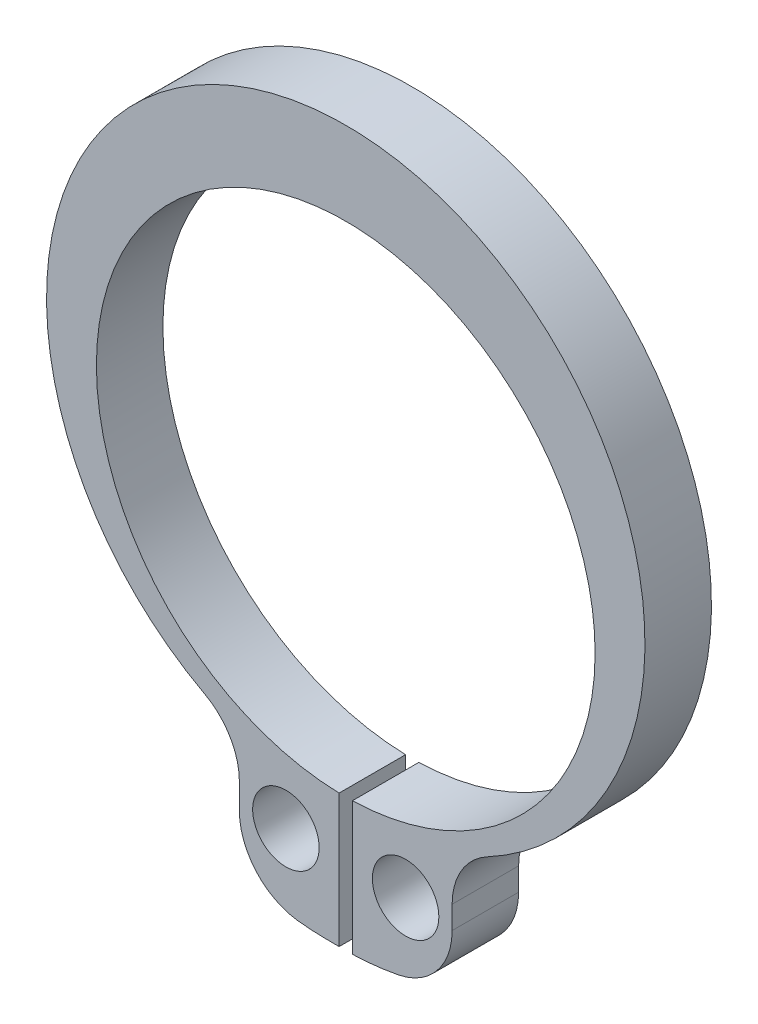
SolidWorks part; units mm, degrees
ref_plane "Plan de face" through (0, 0, 0) normal (0, 0, 1) x (1, 0, 0)
ref_plane "Plan de dessus" through (0, 0, 0) normal (0, 1, 0) x (1, 0, 0)
ref_plane "Plan de droite" through (0, 0, 0) normal (1, 0, 0) x (0, 0, -1)
sketch "Esquisse1" plane through (0, 0, 0) normal (0, 0, 1) x (1, 0, 0)
  line L0 (-0.1, -3.7487) -> (-0.1, -5.7487)
  line L1 (0.1, -3.7487) -> (0.1, -5.7487)
  line L2 (-1.6, -5.4382) -> (-1.6, -3.7059)
  line L3 (1.6, -5.4236) -> (1.6, -3.7059)
  arc A0 (0.1, -3.7487) -> (-0.1, -3.7487) centre (0, 0) ccw
  arc A1 (0.1, -5.7487) -> (1.6, -5.4236) centre (-0.0175, -1.5827) ccw
  arc A3 (1.6, -3.7059) -> (-1.6, -3.7059) centre (0, 0.5) ccw
  spline S0 degree 3 poles (-1.6, -5.4382) (-1.3789, -5.5356) (-0.9021, -5.7456) (-0.38, -5.7476) (-0.1, -5.7487) knots 0 0 0 0 0.463639 1 1 1 1
  dimension "D1" = 7.5
  dimension "D2" = 0.5
  dimension "D4" = 0.1
  dimension "D5" = 0.1
  dimension "D6" = 2
  dimension "D7" = 2
  dimension "D8" = 1.5
  dimension "D9" = 1.5
extrude "Extrusion1" add sketch "Esquisse1" along normal blind 1
sketch "Esquisse2" plane through (0, 0, 1) normal (0, 0, 1) x (1, 0, 0)
  line L0 (1.6, -5.4236) -> (1.6, -3.7059) construction
  line L1 (-1.6, -3.7059) -> (-1.6, -5.4382) construction
  circle A0 centre (-0.9, -4.6108) radius 0.5
  circle A1 centre (0.9, -4.6108) radius 0.5
  dimension "D1" = 0.7
  dimension "D2" = 1
  dimension "D3" = 0.7
  dimension "D4" = 1
extrude "Enlèv. mat.-Extru.1" cut sketch "Esquisse2" against normal blind 1
fillet "Congé1" radius 1 4 edges at (1.6, -5.4236, 0.5) (-1.6, -5.4382, 0.5) (-1.6, -3.7059, 0.5) (1.6, -3.7059, 0.5)
